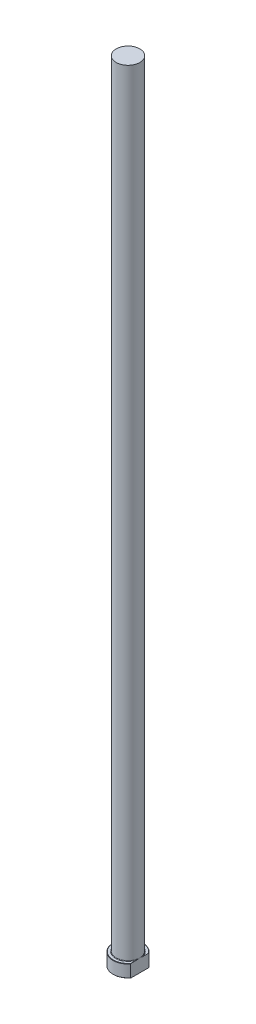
SolidWorks part; units mm, degrees
ref_plane "Front Plane" through (0, 0, 0) normal (0, 0, 1) x (1, 0, 0)
ref_plane "Top Plane" through (0, 0, 0) normal (0, 1, 0) x (1, 0, 0)
ref_plane "Right Plane" through (0, 0, 0) normal (1, 0, 0) x (0, 0, -1)
sketch "Sketch1" plane through (0, 0, 0) normal (0, 0, 1) x (1, 0, 0)
  line L0 (0, 259.9588) -> (0, -15.1925) construction
  line L1 (0, 0) -> (-9.5, 0)
  line L2 (-9.5, 0) -> (-9.5, 8)
  line L3 (-9.5, 8) -> (-7.5, 8)
  line L4 (-7.5, 8) -> (-7.5, 500)
  line L5 (-7.5, 500) -> (0, 500)
  line L6 (0, 500) -> (0, 0)
  dimension "L" = 500
  dimension "H" = 19
  dimension "T" = 8
  dimension "D" = 15
revolve "Revolve1" add sketch "Sketch1" angle 360 about L0
chamfer "Chamfer1" distance 0.2 angle 45 2 edges at (0, 8, 9.5) (0, 0, 9.5)
fillet "Fillet1" radius 0.3 1 edges at (0, 8, 7.5)
sketch "Sketch2" plane through (0, 0, 0) normal (0, 1, 0) x (1, 0, 0)
  line L0 (7.5, -5.831) -> (7.5, 5.831)
  circle A0 centre (0, 0) radius 9.5 construction
  arc A1 (7.5, -5.831) -> (7.5, 5.831) centre (0, 0) ccw
  circle A2 centre (0, 0) radius 7.5 construction
extrude "KEYED HEAD" cut sketch "Sketch2" along normal through all
